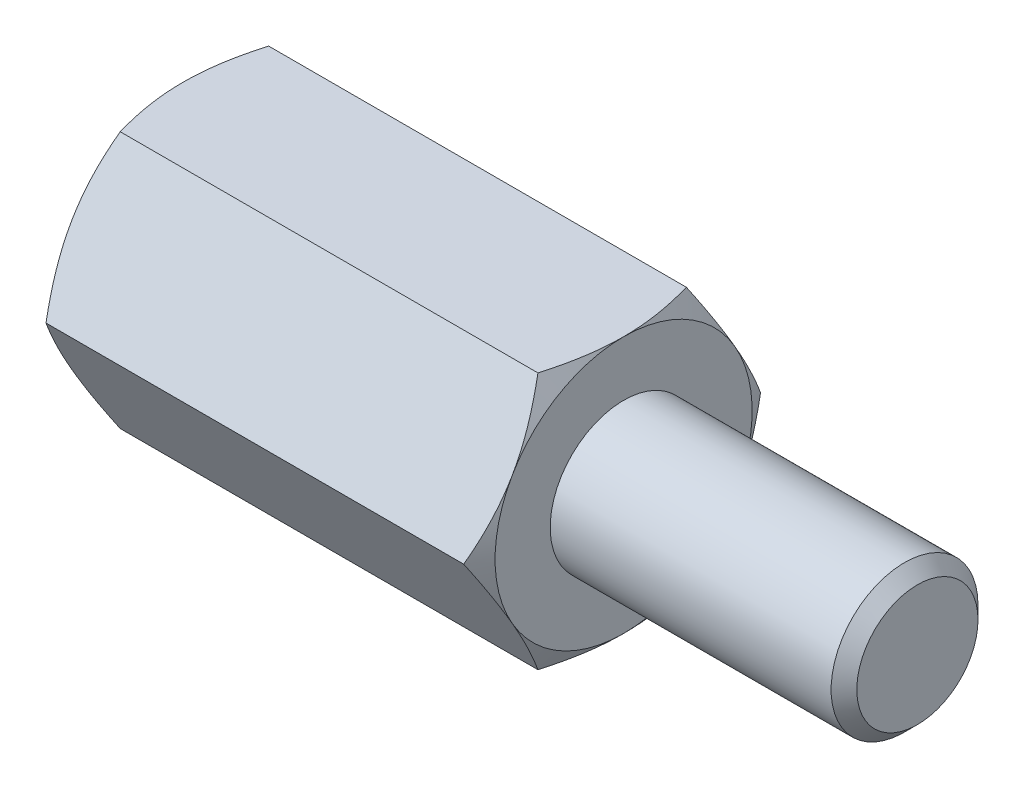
SolidWorks part; units mm, degrees
ref_plane "Front Plane" through (0, 0, 0) normal (0, 0, 1) x (1, 0, 0)
ref_plane "Top Plane" through (0, 0, 0) normal (0, 1, 0) x (1, 0, 0)
ref_plane "Right Plane" through (0, 0, 0) normal (1, 0, 0) x (0, 0, -1)
sketch "Sketch1" plane through (0, 0, 0) normal (1, 0, 0) x (0, 0, -1)
  line L1 (2.0207, 3.5) -> (-2.0207, 3.5)
  line L2 (-2.0207, 3.5) -> (-4.0415, 0)
  line L3 (-4.0415, 0) -> (-2.0207, -3.5)
  line L4 (-2.0207, -3.5) -> (2.0207, -3.5)
  line L5 (2.0207, -3.5) -> (4.0415, 0)
  line L6 (4.0415, 0) -> (2.0207, 3.5)
  circle A0 centre (0, 0) radius 3.5 construction
  dimension "D1" = 7
extrude "Extrude2" add sketch "Sketch1" along normal mid plane 12
sketch "Sketch2" plane through (0, 0, 0) normal (0, 0, 1) x (1, 0, 0)
  line L0 (-6, 3.5) -> (-4.5, 6.0981)
  line L1 (-6, 6.5) -> (-6, 3.5)
  line L3 (0, 0) -> (50000, 0) construction
  arc A0 (-4.5, 6.0981) -> (-6, 6.5) centre (-5.1962, 6.5) ccw
  dimension "D1" = 30
  dimension "D2" = 3
revolve "Cut-Revolve1" cut sketch "Sketch2" angle 360 about L3
mirror "Mirror1" about plane through (0, 0, 0) normal (1, 0, 0) of "Cut-Revolve1"
sketch "Sketch3" plane through (-6, 0, 0) normal (-1, 0, 0) x (0, 0, 1)
  circle A0 centre (0, 0) radius 1.65
  dimension "D1" = 3.3
extrude "Extrude3" cut sketch "Sketch3" against normal blind 8
sketch "Sketch4" plane through (0, 0, 0) normal (0, 0, 1) x (1, 0, 0)
  line L0 (2, 0) -> (2, 1.65)
  line L1 (5.6874, 0) -> (-5.6874, 0) construction
  line L2 (2, 1.65) -> (2.9526, 0)
  line L3 (2.9526, 0) -> (2, 0)
  line L4 (-6, 1.75) -> (-6, -1.75) construction
  point P4 (-6, 0)
  dimension "D1" = 30
  dimension "D2" = 1.65
  dimension "D3" = 8
revolve "Cut-Revolve2" cut sketch "Sketch4" angle 360 about L3
sketch "Sketch5" plane through (6, 0, 0) normal (1, 0, 0) x (0, 0, -1)
  circle A0 centre (0, 0) radius 2
  dimension "D1" = 4
extrude "Extrude4" add sketch "Sketch5" along normal blind 8
chamfer "Chamfer1" distance 0.35 angle 45 1 edges at (14, 0, -2)
equation "\"D2@Sketch4\" = \"D1@Sketch3\"/2"
